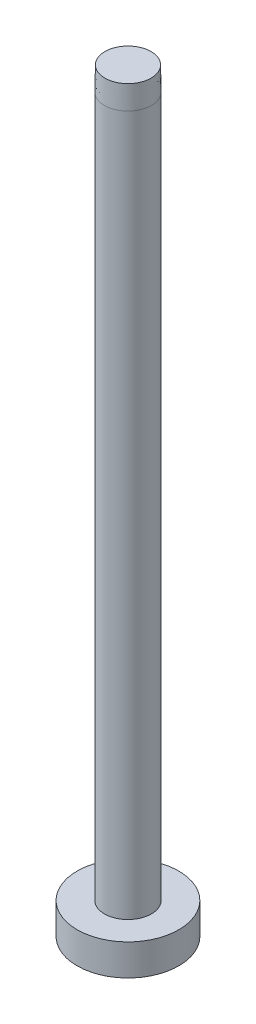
SolidWorks part; units mm, degrees
ref_plane "Face" through (0, 0, 0) normal (0, 0, 1) x (1, 0, 0)
ref_plane "Dessus" through (0, 0, 0) normal (0, 1, 0) x (1, 0, 0)
ref_plane "Droite" through (0, 0, 0) normal (1, 0, 0) x (0, 0, -1)
sketch "Esquisse1" plane through (0, 0, 0) normal (0, 0, 1) x (1, 0, 0)
  line L0 (0, 49.4323) -> (0, -48.5112) construction
  line L1 (0, 0) -> (-6.5, 0)
  line L2 (-6.5, 0) -> (-6.5, 4)
  line L3 (-6.5, 4) -> (-3, 4)
  line L4 (-3, 4) -> (-3, 93.5)
  line L5 (-2.9476, 96.5) -> (0, 96.5)
  line L6 (0, 96.5) -> (0, 0)
  line L7 (-2.9476, 96.5) -> (-3, 93.5)
  line L9 (-3, 96.5) -> (-3, 93.5) construction
  dimension "D1" = 96.5
  dimension "D2" = 4
  dimension "D3" = 13
  dimension "D4" = 3
  dimension "D5" = 1
revolve "Base-Révolution" add sketch "Esquisse1" angle 360 about L0
